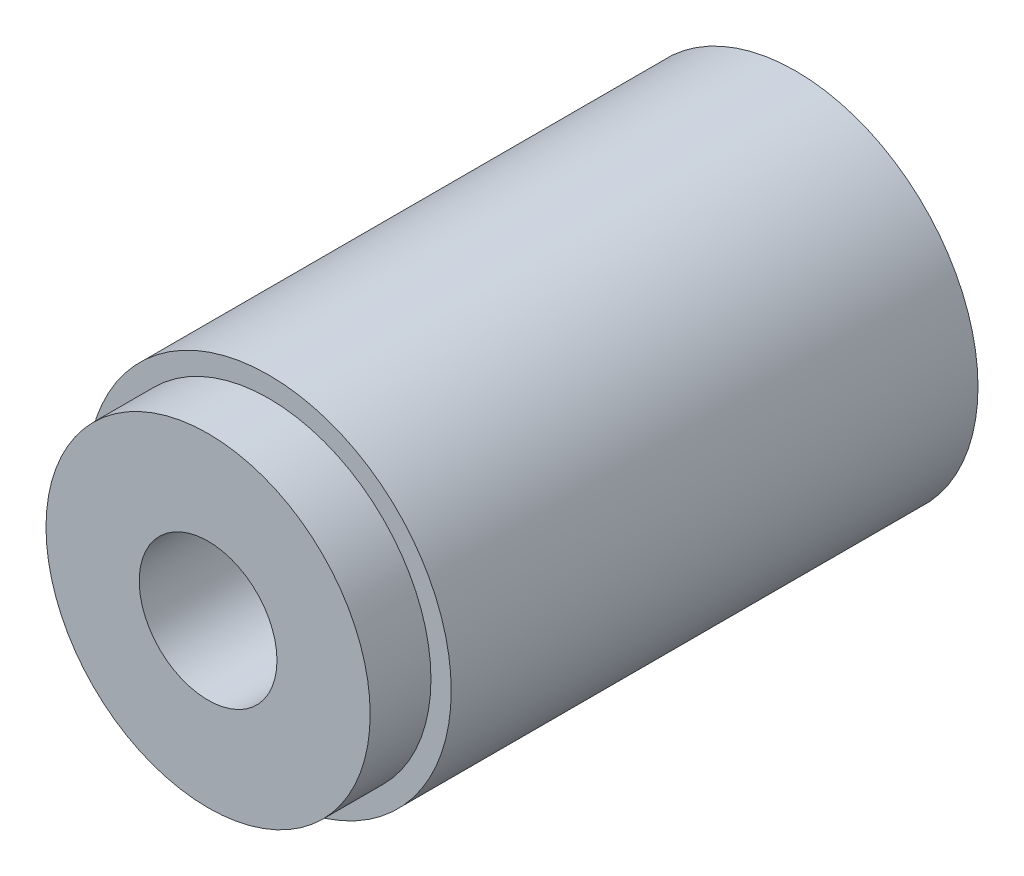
SolidWorks part; units mm, degrees
ref_plane "Plan de face" through (0, 0, 0) normal (0, 0, 1) x (1, 0, 0)
ref_plane "Plan de dessus" through (0, 0, 0) normal (0, 1, 0) x (1, 0, 0)
ref_plane "Plan de droite" through (0, 0, 0) normal (1, 0, 0) x (0, 0, -1)
sketch "Esquisse2" plane through (0, 0, 0) normal (0, 0, 1) x (1, 0, 0)
  circle A0 centre (0, 0) radius 45
  dimension "D1" = 90
extrude "Extrusion1" add sketch "Esquisse2" along normal blind 130
sketch "Esquisse3" plane through (0, 0, 130) normal (0, 0, 1) x (1, 0, 0)
  circle A0 centre (0, 0) radius 40
  dimension "D1" = 80
extrude "Extrusion2" add sketch "Esquisse3" along normal blind 15
sketch "Esquisse4" plane through (0, 0, 145) normal (0, 0, 1) x (1, 0, 0)
  circle A0 centre (0, 0) radius 17
  dimension "D1" = 34
extrude "Enlèv. mat.-Extru.1" cut sketch "Esquisse4" against normal through all
